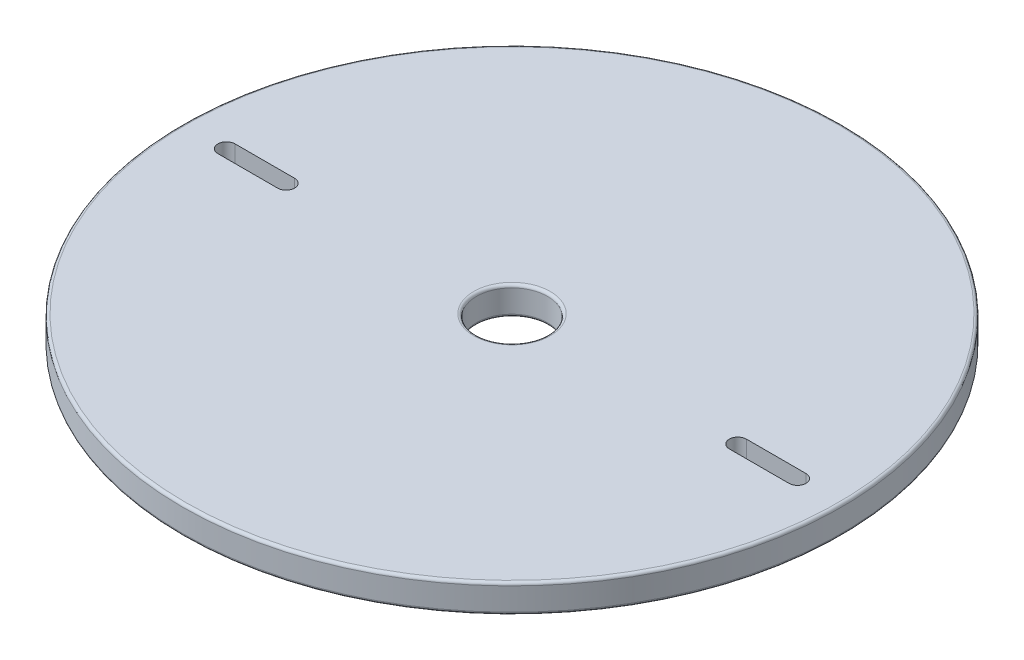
SolidWorks part; units mm, degrees
ref_plane "Front Plane" through (0, 0, 0) normal (0, 0, 1) x (1, 0, 0)
ref_plane "Top Plane" through (0, 0, 0) normal (0, 1, 0) x (1, 0, 0)
ref_plane "Right Plane" through (0, 0, 0) normal (1, 0, 0) x (0, 0, -1)
sketch "Sketch1" plane through (0, 0, 0) normal (0, 1, 0) x (1, 0, 0)
  circle A0 centre (0, 0) radius 11.6
  dimension "D1" = 23.2
extrude "Boss-Extrude1" add sketch "Sketch1" along normal mid plane 1
sketch "Sketch2" plane through (0, 0.5, 0) normal (0, 1, 0) x (1, 0, 0)
  line L0 (-10.05, 0) -> (-7.95, 0) construction
  line L1 (-10.05, 0.3) -> (-7.95, 0.3)
  line L2 (-10.05, -0.3) -> (-7.95, -0.3)
  arc A0 (-10.05, 0.3) -> (-10.05, -0.3) centre (-10.05, 0) ccw
  arc A1 (-7.95, -0.3) -> (-7.95, 0.3) centre (-7.95, 0) ccw
  point P2 (-9, 0)
  dimension "D1" = 2.1
  dimension "D2" = 0.3
  dimension "D3" = 9
extrude "Cut-Extrude1" cut sketch "Sketch2" against normal up to next
mirror "Mirror1" about plane through (0, 0, 0) normal (1, 0, 0) of "Cut-Extrude1"
sketch "Sketch3" plane through (0, 0.5, 0) normal (0, 1, 0) x (1, 0, 0)
  circle A0 centre (0, 0) radius 1.25
  dimension "D1" = 2.5
extrude "Cut-Extrude2" cut sketch "Sketch3" against normal up to next
fillet "Fillet1" radius 0.1 4 edges at (0, -0.5, 11.6) (0, 0.5, 11.6) (0, -0.5, 1.25) (0, 0.5, 1.25)
